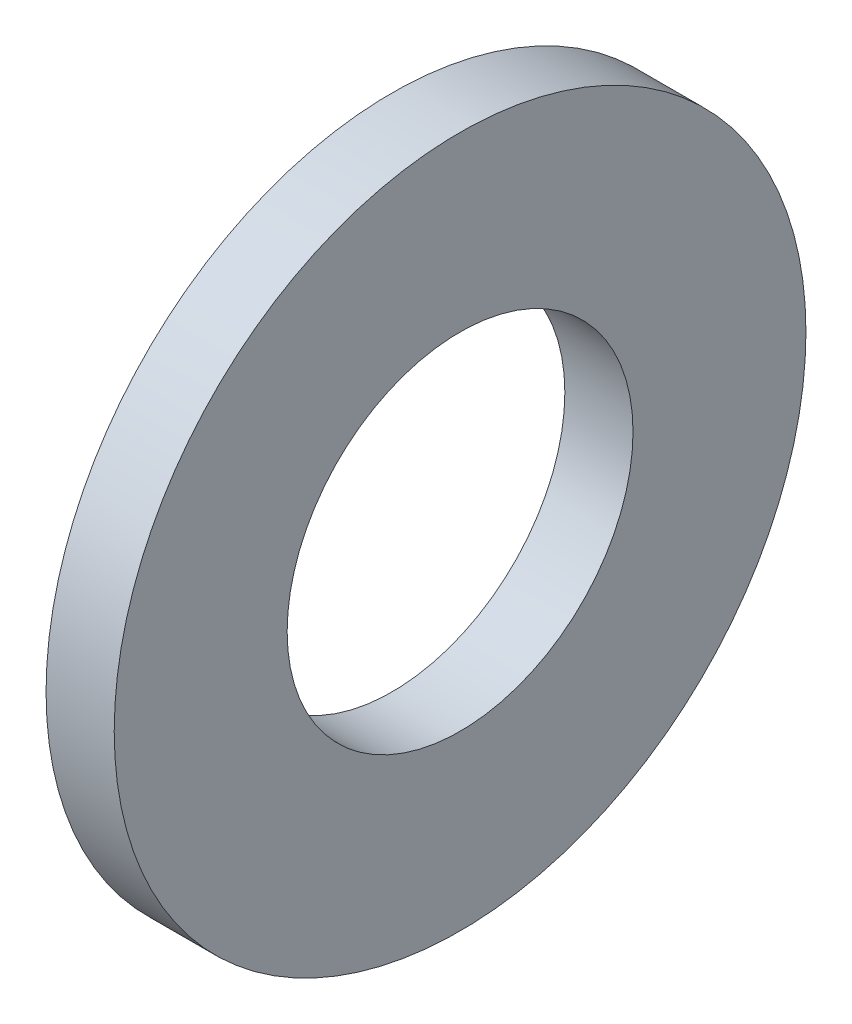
SolidWorks part; units mm, degrees
ref_plane "Plane1" through (0, 0, 0) normal (0, 0, 1) x (1, 0, 0)
ref_plane "Plane2" through (0, 0, 0) normal (0, 1, 0) x (1, 0, 0)
ref_plane "Plane3" through (0, 0, 0) normal (1, 0, 0) x (0, 0, -1)
sketch "Sketch1" plane through (0, 0, 0) normal (0, 0, 1) x (1, 0, 0)
  line L0 (-34.925, 0) -> (9.525, 0) construction
  line L1 (0, 2.5781) -> (0, 5.1562)
  line L2 (0, 5.1562) -> (-1.016, 5.1562)
  line L3 (-1.016, 5.1562) -> (-1.016, 2.5781)
  line L4 (-1.016, 2.5781) -> (0, 2.5781)
  dimension "Thickness" = 1.016
  dimension "Inside_dia" = 5.1562
  dimension "Outside_dia" = 10.3124
revolve "Base-Revolve" add sketch "Sketch1" angle 360 about L0
